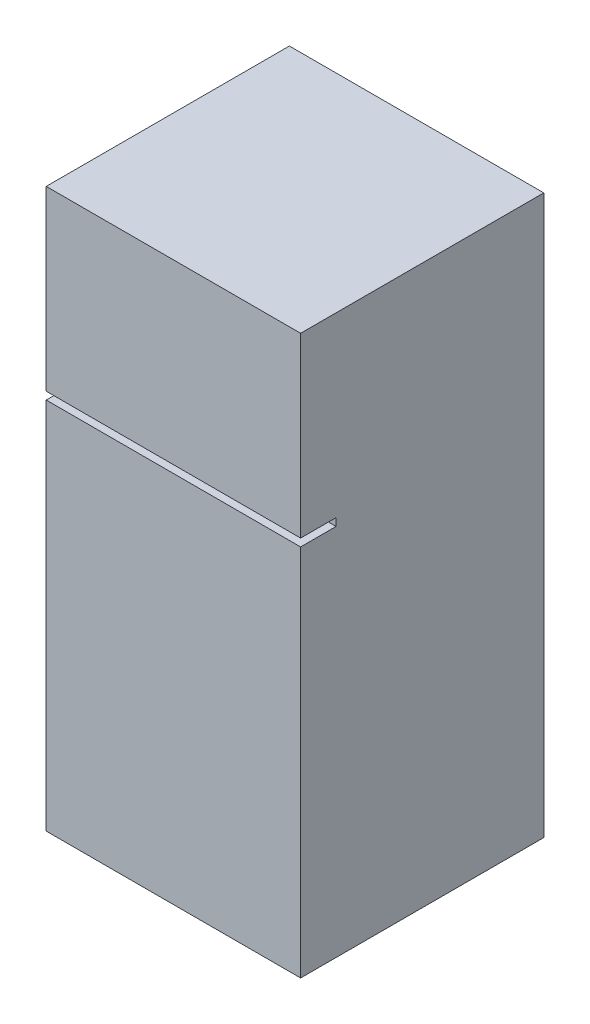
SolidWorks part; units mm, degrees
ref_plane "Front Plane" through (0, 0, 0) normal (0, 0, 1) x (1, 0, 0)
ref_plane "Top Plane" through (0, 0, 0) normal (0, 1, 0) x (1, 0, 0)
ref_plane "Right Plane" through (0, 0, 0) normal (1, 0, 0) x (0, 0, -1)
sketch "Sketch1" plane through (0, 0, 0) normal (0, 1, 0) x (1, 0, 0)
  line L1 (0, 0) -> (717.55, 0)
  line L2 (0, 0) -> (0, 685.8)
  line L3 (0, 685.8) -> (717.55, 685.8)
  line L4 (717.55, 0) -> (717.55, 685.8)
  dimension "D1" = 685.8
  dimension "D2" = 717.55
extrude "Boss-Extrude1" add sketch "Sketch1" along normal blind 1574.8
sketch "Sketch2" plane through (0, 0, 0) normal (0, 0, 1) x (1, 0, 0)
  line L1 (-39.9855, 1074.4693) -> (784.0855, 1074.4693)
  line L2 (-39.9855, 1074.4693) -> (-39.9855, 1052.938)
  line L3 (-39.9855, 1052.938) -> (784.0855, 1052.938)
  line L4 (784.0855, 1074.4693) -> (784.0855, 1052.938)
extrude "Cut-Extrude1" cut sketch "Sketch2" against normal blind 100
